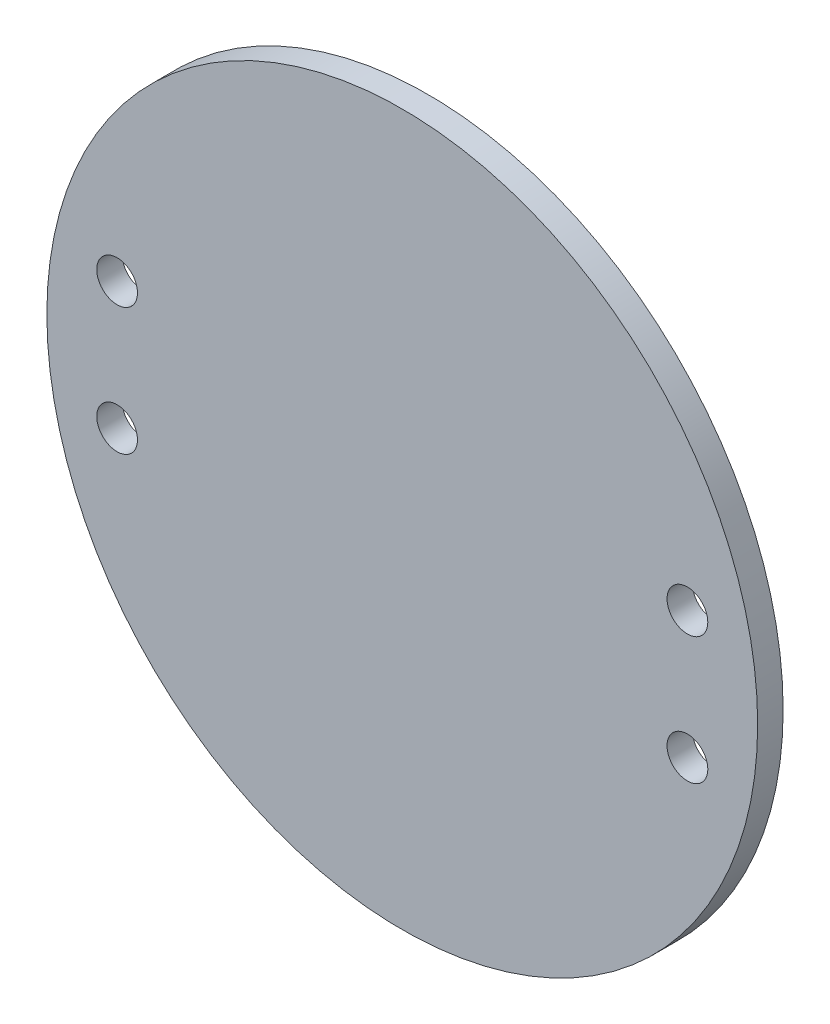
SolidWorks part; units mm, degrees
ref_plane "Front Plane" through (0, 0, 0) normal (0, 0, 1) x (1, 0, 0)
ref_plane "Top Plane" through (0, 0, 0) normal (0, 1, 0) x (1, 0, 0)
ref_plane "Right Plane" through (0, 0, 0) normal (1, 0, 0) x (0, 0, -1)
sketch "Sketch1" plane through (0, 0, 0) normal (0, 0, 1) x (1, 0, 0)
  circle A0 centre (0, 0) radius 22.1615
  circle A1 centre (-17.78, 3.9688) radius 1.27
  circle A2 centre (17.78, 3.9688) radius 1.27
  circle A9 centre (17.78, -3.9688) radius 1.27
  circle A10 centre (-17.78, -3.9688) radius 1.27
extrude "Extrude1" add sketch "Sketch1" along normal blind 1.5875
